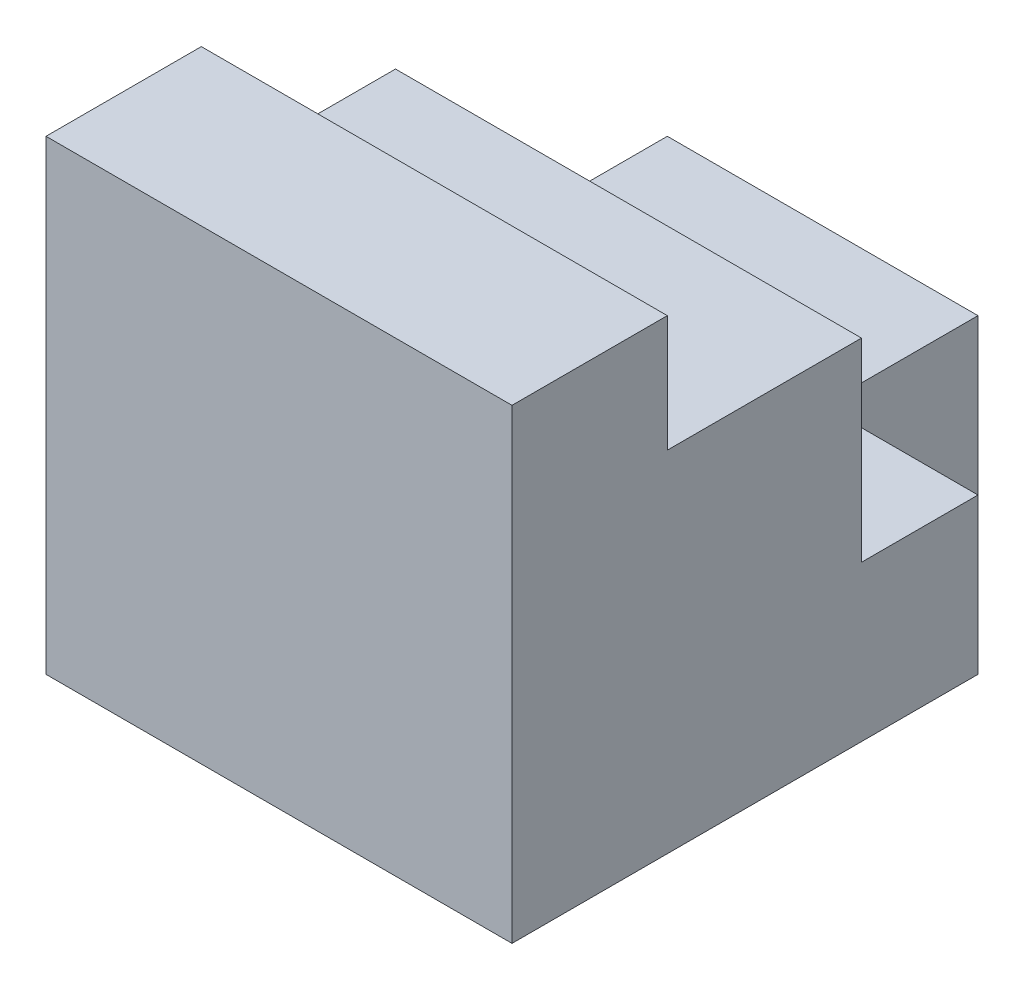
SolidWorks part; units mm, degrees
ref_plane "Ebene vorne" through (0, 0, 0) normal (0, 0, 1) x (1, 0, 0)
ref_plane "Ebene oben" through (0, 0, 0) normal (0, 1, 0) x (1, 0, 0)
ref_plane "Ebene rechts" through (0, 0, 0) normal (1, 0, 0) x (0, 0, -1)
sketch "Skizze1" plane through (0, 0, 0) normal (1, 0, 0) x (0, 0, -1)
  line L0 (0, 0) -> (0, 60)
  line L1 (0, 60) -> (20, 60)
  line L2 (20, 60) -> (20, 45)
  line L3 (20, 45) -> (45, 45)
  line L4 (45, 45) -> (45, 20)
  line L5 (45, 20) -> (80, 20)
  line L6 (80, 20) -> (80, 0)
  line L7 (80, 0) -> (0, 0)
  dimension "D1" = 80
  dimension "D2" = 35
  dimension "D3" = 20
  dimension "D4" = 60
  dimension "D5" = 20
  dimension "D6" = 15
extrude "Aufsatz-Linear austragen1" add sketch "Skizze1" along normal blind 60
sketch "Skizze3" plane through (0, 20, 0) normal (0, 1, 0) x (1, 0, 0)
  line L1 (60, 80) -> (40, 80)
  line L2 (60, 80) -> (60, 60)
  line L3 (60, 60) -> (40, 60)
  line L4 (40, 80) -> (40, 60)
  dimension "D1" = 20
extrude "Schnitt-Linear austragen1" cut sketch "Skizze3" against normal through all
